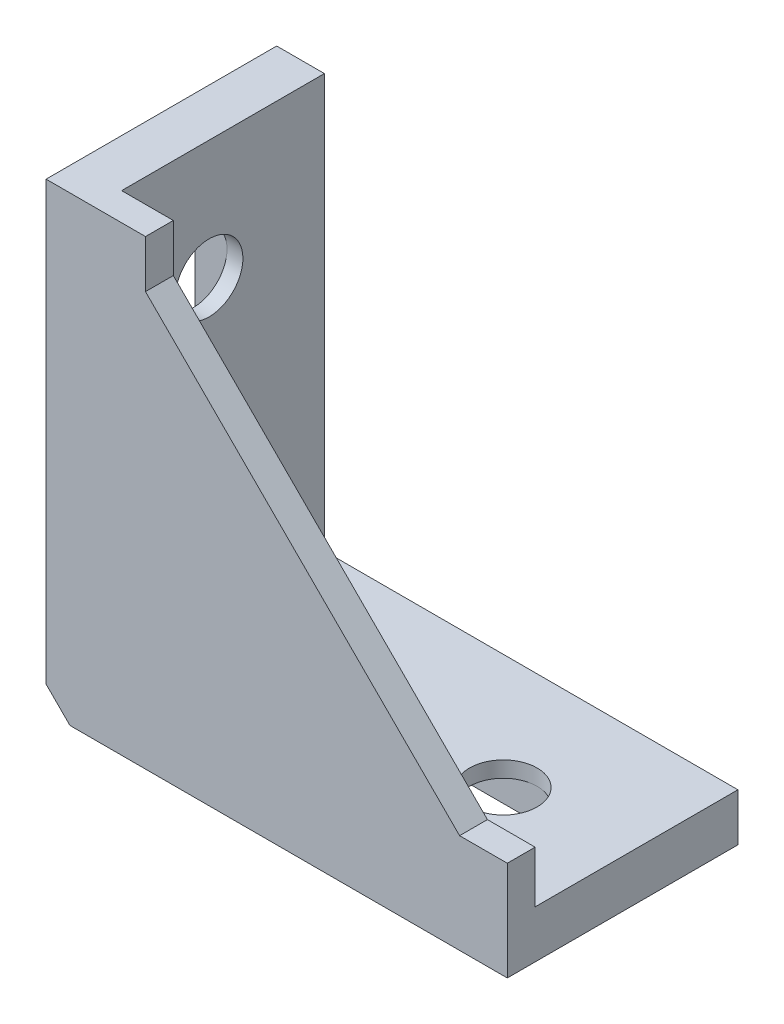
SolidWorks part; units mm, degrees
ref_plane "前视基准面" through (0, 0, 0) normal (0, 0, 1) x (1, 0, 0)
ref_plane "上视基准面" through (0, 0, 0) normal (0, 1, 0) x (1, 0, 0)
ref_plane "右视基准面" through (0, 0, 0) normal (1, 0, 0) x (0, 0, -1)
sketch "草图1" plane through (0, 0, 0) normal (0, 0, 1) x (1, 0, 0)
  line L0 (-42.3884, 57.4837) -> (-36.3884, 57.4837)
  line L1 (-36.3884, 57.4837) -> (-36.3884, 5.4837)
  line L2 (-36.3884, 5.4837) -> (15.6116, 5.4837)
  line L3 (15.6116, 5.4837) -> (15.6116, -0.5163)
  line L4 (15.6116, -0.5163) -> (-42.3884, -0.5163)
  line L5 (-42.3884, -0.5163) -> (-42.3884, 57.4837)
  dimension "D1" = 6
  dimension "D2" = 58
  dimension "D3" = 58
  dimension "D4" = 52
  dimension "D5" = 52
extrude "凸台-拉伸1" add sketch "草图1" along normal blind 29
sketch "草图2" plane through (0, 0, 29) normal (0, 0, 1) x (1, 0, 0)
  line L0 (-36.3884, 57.4837) -> (-29.8884, 57.4837)
  line L1 (-29.8884, 57.4837) -> (-29.8884, 51.4837)
  line L2 (-29.8884, 51.4837) -> (9.6116, 11.9837)
  line L3 (15.6116, 5.4837) -> (15.6116, 11.9837)
  line L4 (15.6116, 11.9837) -> (9.6116, 11.9837)
  line L5 (-36.3884, 57.4837) -> (-36.3884, 5.4837)
  line L6 (-36.3884, 5.4837) -> (15.6116, 5.4837)
  dimension "D1" = 6.5
  dimension "D2" = 6.5
  dimension "D3" = 6
  dimension "D4" = 6
extrude "凸台-拉伸2" add sketch "草图2" against normal blind 3.5
sketch "草图3" plane through (-42.3884, 0, 0) normal (-1, 0, 0) x (0, 0, 1)
  line L0 (14.5, 57.4837) -> (14.5, -0.5163)
  line L1 (29, 57.4837) -> (0, 57.4837) construction
  line L2 (29, -0.5163) -> (0, -0.5163) construction
  line L3 (14.5, 26.4837) -> (14.5, 14.4837) construction
  line L4 (18.75, 26.4837) -> (18.75, 14.4837)
  line L5 (10.25, 26.4837) -> (10.25, 14.4837)
  circle A0 centre (14.5, 42.4837) radius 4.25
  arc A1 (18.75, 26.4837) -> (10.25, 26.4837) centre (14.5, 26.4837) ccw
  arc A2 (10.25, 14.4837) -> (18.75, 14.4837) centre (14.5, 14.4837) ccw
  point P10 (14.5, 20.4837)
  dimension "D1" = 12
  dimension "D2" = 15
  dimension "D3" = 15
extrude "切除-拉伸1" cut sketch "草图3" against normal through all contours L0 A2 L4 A1 | L0 A0 | L0 A0 | L5 A2 L0 A1
sketch "草图4" plane through (-42.3884, 0, 0) normal (-1, 0, 0) x (0, 0, 1)
  line L0 (3.5, 53.6602) -> (8.5, 53.6602)
  line L1 (8.5, 53.6602) -> (8.5, 6.4837)
  line L2 (8.5, 6.4837) -> (3.5, 6.4837)
  line L3 (3.5, 6.4837) -> (3.5, 53.6602)
  line L4 (21.5, 53.6602) -> (25.5, 53.6602)
  line L5 (25.5, 53.6602) -> (25.5, 5.8807)
  line L6 (25.5, 5.8807) -> (21.5, 5.8807)
  line L7 (21.5, 5.8807) -> (21.5, 53.6602)
  line L8 (10.25, 42.4837) -> (10.25, 50.4837)
  line L9 (10.25, 50.4837) -> (18.75, 50.4837)
  line L10 (18.75, 50.4837) -> (18.75, 6.4837)
  line L11 (18.75, 6.4837) -> (10.25, 6.4837)
  line L12 (10.25, 6.4837) -> (10.25, 50.4837)
  line L13 (0, 57.4837) -> (0, -0.5163) construction
  line L14 (29, 57.4837) -> (29, -0.5163) construction
  line L15 (29, 57.4837) -> (0, 57.4837) construction
  circle A1 centre (14.5, 42.4837) radius 4.25 construction
  dimension "D1" = 3.5
  dimension "D2" = 3.5
  dimension "D3" = 4
  dimension "D4" = 5
  dimension "D5" = 8.5
  dimension "D6" = 44
  dimension "D7" = 7
extrude "切除-拉伸2" cut sketch "草图4" against normal blind 4 contours L3 L2 L1 L0 | L12 L10 M2 M5 | L10 L9 L8 M5 | L7 L6 L5 L4 | L12 L11 L10 M4
ref_plane "基准面1" through (-20.9361, 20.9361, 0) normal (0.7071, -0.7071, 0) x (0, 0, -1)
mirror "镜向1" about plane through (-20.9361, 20.9361, 0) normal (0.7071, -0.7071, 0) of "切除-拉伸2", "切除-拉伸1"
sketch "草图5" plane through (-42.3884, 0, 0) normal (-1, 0, 0) x (0, 0, 1)
  line L0 (12, 6.4837) -> (12, 4.4837)
  line L1 (18.75, 6.4837) -> (10.25, 6.4837) construction
  line L2 (12, 4.4837) -> (19, 4.4837)
  line L3 (19, 4.4837) -> (19, 6.4837)
  line L4 (19, 6.4837) -> (12, 6.4837)
  line L5 (19, 50.4837) -> (19, 52.4837)
  line L6 (10.25, 50.4837) -> (18.75, 50.4837) construction
  line L7 (19, 52.4837) -> (12, 52.4837)
  line L8 (12, 52.4837) -> (12, 50.4837)
  line L9 (12, 50.4837) -> (19, 50.4837)
  line L10 (0, 57.4837) -> (0, -0.5163) construction
  dimension "D1" = 7
  dimension "D2" = 7
  dimension "D3" = 2
  dimension "D4" = 2
  dimension "D5" = 12
  dimension "D6" = 12
extrude "凸台-拉伸3" add sketch "草图5" along normal blind 2
mirror "镜向2" about plane through (-20.9361, 20.9361, 0) normal (0.7071, -0.7071, 0) of "凸台-拉伸3"
chamfer "倒角1" distance 3 angle 45 1 edges at (-42.3884, -0.5163, 14.5)
